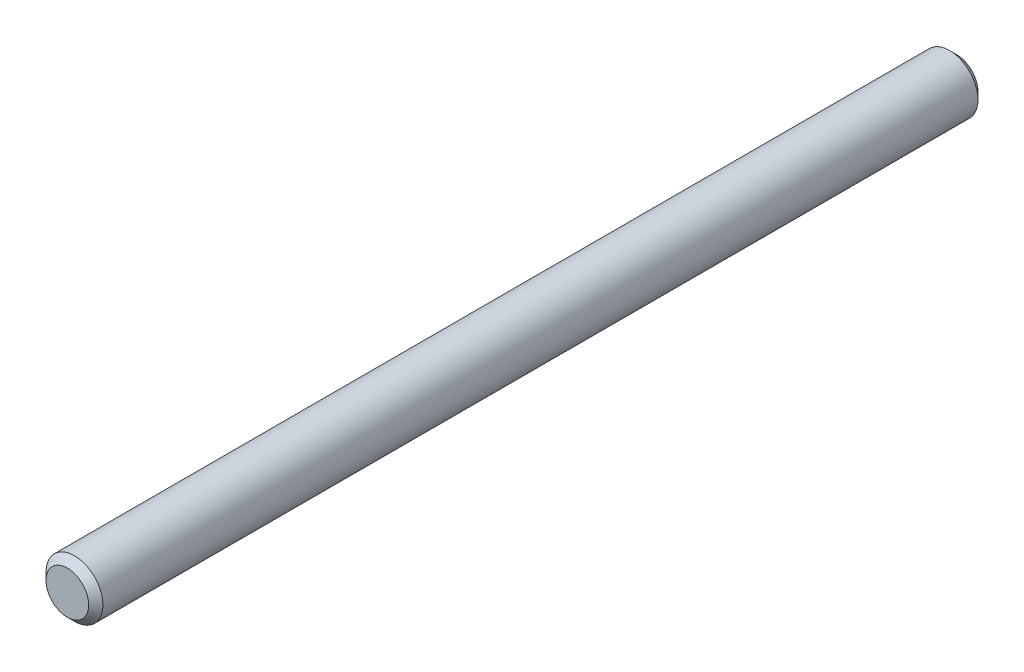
SolidWorks part; units mm, degrees
ref_plane "face" through (0, 0, 0) normal (0, 0, 1) x (1, 0, 0)
ref_plane "dessus" through (0, 0, 0) normal (0, 1, 0) x (1, 0, 0)
ref_plane "coté" through (0, 0, 0) normal (1, 0, 0) x (0, 0, -1)
sketch "Esquisse1" plane through (0, 0, 0) normal (0, 0, 1) x (1, 0, 0)
  circle A0 centre (0, 0) radius 8
  dimension "D1" = 16
extrude "Extrusion1" add sketch "Esquisse1" along normal blind 250
chamfer "Chanfrein1" distance 2 angle 45 2 edges at (8, 0, 0) (8, 0, 250)
